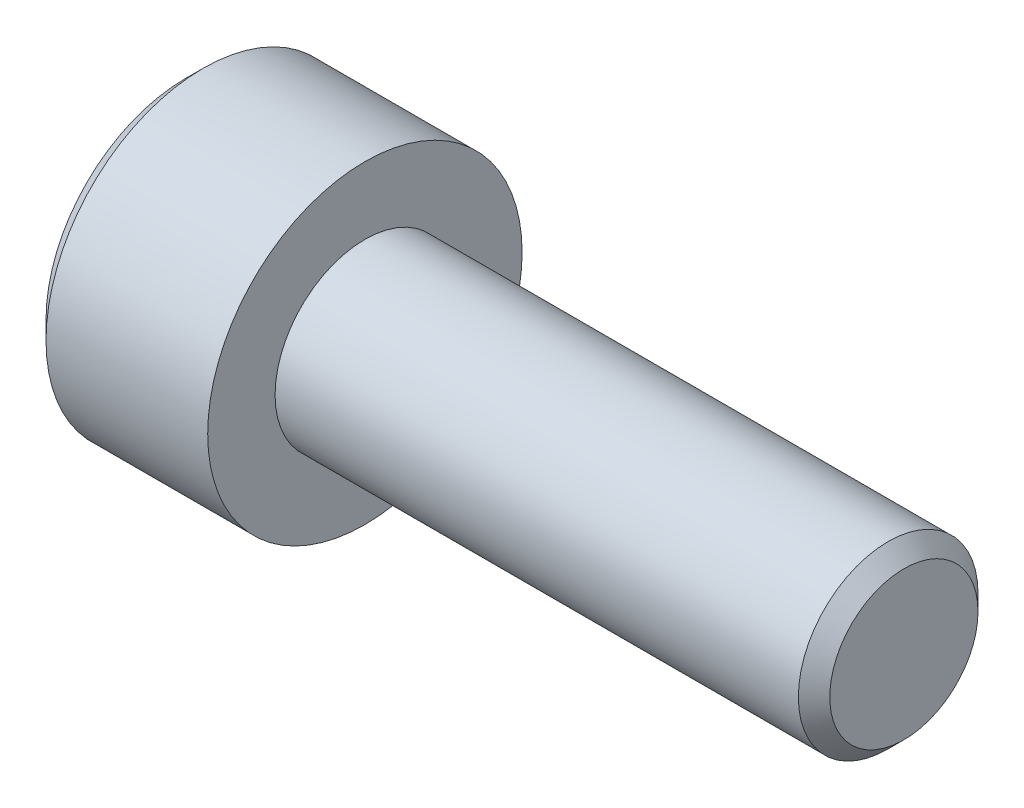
SolidWorks part; units mm, degrees
ref_plane "Front Plane" through (0, 0, 0) normal (0, 0, 1) x (1, 0, 0)
ref_plane "Top Plane" through (0, 0, 0) normal (0, 1, 0) x (1, 0, 0)
ref_plane "Right Plane" through (0, 0, 0) normal (1, 0, 0) x (0, 0, -1)
sketch "Sketch1" plane through (0, 0, 0) normal (1, 0, 0) x (0, 0, -1)
  circle A0 centre (0, 0) radius 3.5
  dimension "D1" = 7
extrude "Boss-Extrude1" add sketch "Sketch1" along normal blind 4
sketch "Sketch2" plane through (0, 0, 0) normal (-1, 0, 0) x (0, 0, 1)
  line L1 (-1.7321, 0) -> (-0.866, -1.5)
  line L2 (-0.866, -1.5) -> (0.866, -1.5)
  line L3 (0.866, -1.5) -> (1.7321, 0)
  line L4 (1.7321, 0) -> (0.866, 1.5)
  line L5 (0.866, 1.5) -> (-0.866, 1.5)
  line L6 (-0.866, 1.5) -> (-1.7321, 0)
  circle A0 centre (0, 0) radius 1.5 construction
  dimension "D1" = 3
extrude "Cut-Extrude1" cut sketch "Sketch2" against normal blind 2.2
chamfer "Chamfer1" distance 0.4 angle 45 1 edges at (0, 0, -3.5)
sketch "Sketch4" plane through (4, 0, 0) normal (1, 0, 0) x (0, 0, -1)
  circle A0 centre (0, 0) radius 2
  dimension "D1" = 4
extrude "Boss-Extrude2" add sketch "Sketch4" along normal blind 12
chamfer "Chamfer2" distance 0.35 angle 45 1 edges at (16, 0, -2)
